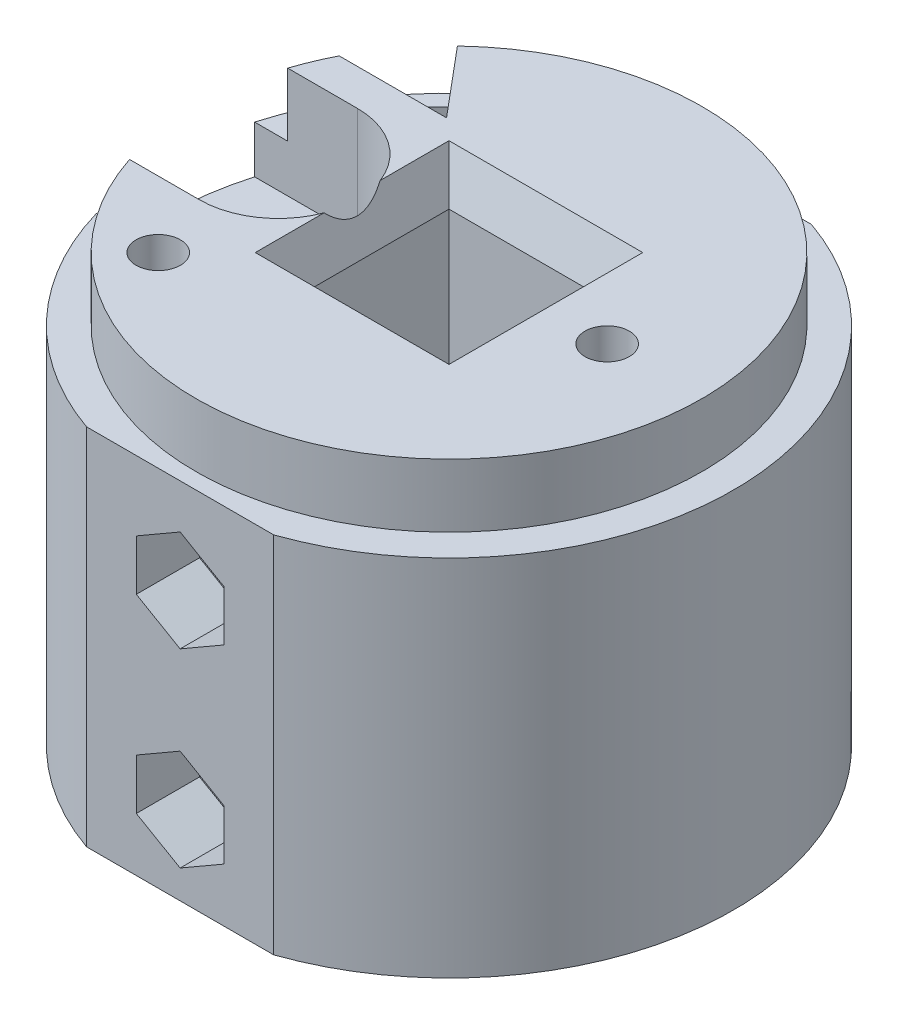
SolidWorks part; units mm, degrees
ref_plane "Спереди" through (0, 0, 0) normal (0, 0, 1) x (1, 0, 0)
ref_plane "Сверху" through (0, 0, 0) normal (0, 1, 0) x (1, 0, 0)
ref_plane "Справа" through (0, 0, 0) normal (1, 0, 0) x (0, 0, -1)
sketch "Sketch1" plane through (0, 0, 0) normal (0, 1, 0) x (1, 0, 0)
  line L0 (-5.125, 0) -> (-18, 0) construction
  line L1 (5.125, -5.125) -> (-5.125, -5.125)
  line L2 (5.125, -5.125) -> (5.125, 5.125)
  line L3 (5.125, 5.125) -> (-5.125, 5.125)
  line L4 (-5.125, -5.125) -> (-5.125, 5.125)
  line L5 (5.125, -5.125) -> (-5.125, 5.125) construction
  line L6 (5.125, 5.125) -> (-5.125, -5.125) construction
  circle A0 centre (0, 0) radius 18
  circle A1 centre (-12, 0) radius 2
  dimension "D1" = 36
  dimension "D3" = 6
  dimension "D2" = 10.25
extrude "Boss-Extrude1" add sketch "Sketch1" along normal blind 27
sketch "Sketch2" plane through (0, 27, 0) normal (0, 1, 0) x (1, 0, 0)
  line L0 (-10.8, 5) -> (-17.2916, 5)
  line L1 (-10.8, -5) -> (-17.2916, -5)
  line L2 (-5.125, 0) -> (-18, 0) construction
  line L3 (-5.125, 5.125) -> (-5.125, -5.125) construction
  circle A1 centre (0, 0) radius 18 construction
  arc A2 (-17.2916, 5) -> (-17.2916, -5) centre (0, 0) ccw
  arc A3 (-10.8, 5) -> (-10.8, -5) centre (-10.8, 0) cw
  point P12 (-5.8, 0)
  dimension "D1" = 5
extrude "Cut-Extrude1" cut sketch "Sketch2" against normal blind 7
sketch "Sketch4" plane through (0, 0, 0) normal (0, -1, 0) x (-1, 0, 0)
  line L0 (0, 0) -> (18, 21.4516) construction
  line L1 (0, 0) -> (18, -21.4516) construction
  line L2 (18, 21.4516) -> (18, -21.4516) construction
  line L3 (0, 0) -> (13.6996, 11.6756) construction
  line L4 (0, 0) -> (13.6996, -11.6756) construction
  line L5 (0, 0) -> (18, 0) construction
  line L6 (5.125, 5.125) -> (5.125, -5.125) construction
  line L7 (11.5702, 13.7888) -> (5.1423, 6.1284) construction
  line L8 (5.1423, 6.1284) -> (5.1423, -4.3826) construction
  line L9 (5.1423, -4.3826) -> (13.6996, -11.6756) construction
  line L10 (5.1423, 0.8729) -> (18.1354, 0.8729) construction
  line L12 (15.8104, 5.5479) -> (6.4604, 5.5479)
  line L13 (15.8104, 5.5479) -> (15.8104, -3.8021)
  line L14 (15.8104, -3.8021) -> (6.4604, -3.8021)
  line L15 (6.4604, 5.5479) -> (6.4604, -3.8021)
  line L16 (15.8104, 5.5479) -> (6.4604, -3.8021) construction
  line L17 (15.8104, -3.8021) -> (6.4604, 5.5479) construction
  arc A0 (13.6996, -11.6756) -> (11.5702, 13.7888) centre (0.5154, 0.0431) ccw construction
  circle A2 centre (0, 0) radius 18 construction
  point P2 (11, 0)
  point P5 (11.5702, 13.7888)
  point P7 (4.1157, 3.5076)
  point P8 (11.5702, -13.7888)
  point P11 (5.125, -6.1077)
  point P16 (11.1354, 0.8729)
  dimension "D5" = 10
  dimension "D1" = 100
  dimension "D2" = 3
  dimension "D3" = 3
  dimension "D4" = 9.35
  dimension "D6" = 7
extrude "Cut-Extrude3" cut sketch "Sketch4" against normal blind 15.4
sketch "Sketch5" plane through (0, 27, 0) normal (0, 1, 0) x (1, 0, 0)
  line L0 (0, 18) -> (0, -18) construction
  line L1 (5.9161, 17) -> (-5.9161, 17)
  line L2 (5.9161, -17) -> (-5.9161, -17)
  circle A0 centre (0, 0) radius 18 construction
  arc A1 (5.9161, 17) -> (-5.9161, 17) centre (0, 0) ccw
  arc A2 (5.9161, -17) -> (-5.9161, -17) centre (0, 0) cw
  point P11 (0, 17)
  dimension "D1" = 1
extrude "Cut-Extrude4" cut sketch "Sketch5" against normal blind 40
sketch "Sketch6" plane through (0, 0, -17) normal (0, 0, -1) x (-1, 0, 0)
  line L0 (0, 27) -> (0, 0) construction
  line L1 (5.9161, 27) -> (-5.9161, 27) construction
  line L3 (5.9161, 0) -> (-5.9161, 0) construction
  circle A0 centre (0, 17) radius 1.5
  circle A1 centre (0, 5) radius 1.5
  dimension "D1" = 3
  dimension "D2" = 10
  dimension "D3" = 5
extrude "Cut-Extrude5" cut sketch "Sketch6" against normal through all
sketch "Sketch7" plane through (0, 0, -17) normal (0, 0, -1) x (-1, 0, 0)
  circle A0 centre (0, 17) radius 3
  circle A1 centre (0, 5) radius 3
  dimension "D1" = 6
extrude "Cut-Extrude6" cut sketch "Sketch7" against normal blind 3
sketch "Sketch8" plane through (0, 0, 17) normal (0, 0, 1) x (1, 0, 0)
  line L0 (5.9161, 0) -> (5.9161, 27) construction
  line L1 (0, 13.8) -> (2.7713, 15.4)
  line L2 (2.7713, 15.4) -> (2.7713, 18.6)
  line L3 (2.7713, 18.6) -> (0, 20.2)
  line L4 (0, 20.2) -> (-2.7713, 18.6)
  line L5 (-2.7713, 18.6) -> (-2.7713, 15.4)
  line L6 (-2.7713, 15.4) -> (0, 13.8)
  line L9 (0, 1.8) -> (2.7713, 3.4)
  line L10 (2.7713, 3.4) -> (2.7713, 6.6)
  line L11 (2.7713, 6.6) -> (0, 8.2)
  line L12 (0, 8.2) -> (-2.7713, 6.6)
  line L13 (-2.7713, 6.6) -> (-2.7713, 3.4)
  line L14 (-2.7713, 3.4) -> (0, 1.8)
  circle A0 centre (0, 17) radius 3.2 construction
  circle A1 centre (0, 5) radius 3.2 construction
  dimension "D1" = 6.4
extrude "Cut-Extrude7" cut sketch "Sketch8" against normal blind 4
chamfer "Chamfer1" distance 1 angle 70 4 edges at (-5.125, 27, 0) (0, 27, -5.125) (0, 27, 5.125) (5.125, 27, 0)
sketch "Sketch9" plane through (0, 0, 0) normal (0, -1, 0) x (1, 0, 0)
  line L0 (16.4542, -7.2979) -> (-16.4542, -7.2979) construction
  line L1 (-15.8104, -5.5479) -> (-6.4604, -5.5479) construction
  line L2 (-7.4542, -7.2979) -> (-15.4542, -7.2979)
  line L3 (-7.4542, -7.2979) -> (-11.6323, -12.2772)
  line L4 (5.125, -5.125) -> (-5.125, -5.125) construction
  circle A0 centre (0, 0) radius 18 construction
  arc A1 (-15.4542, -7.2979) -> (-11.6323, -12.2772) centre (0.5168, 1.0043) ccw
  point P10 (-11.4542, -7.2979)
  dimension "D8" = 18
  dimension "D1" = 1.75
  dimension "D2" = 5
  dimension "D3" = 6.5
  dimension "D4" = 50
  dimension "D5" = 8
  dimension "D6" = 2.1729
  dimension "D7" = 23.9084
extrude "Cut-Extrude8" cut sketch "Sketch9" against normal through all
sketch "Sketch12" plane through (0, 27, 0) normal (0, 1, 0) x (1, 0, 0)
  line L0 (18, 0) -> (-10.8, 0) construction
  line L1 (0, 0) -> (-12.7279, -12.7279) construction
  arc A0 (5.9161, -17) -> (5.9161, 17) centre (0, 0) ccw construction
  arc A1 (-17.2916, -5) -> (-5.9161, -17) centre (0, 0) ccw construction
  circle A2 centre (10, 0) radius 1.4
  circle A3 centre (-9.1924, -9.1924) radius 1.4
  dimension "D1" = 2.8
  dimension "D2" = 10
  dimension "D3" = 13
extrude "Cut-Extrude10" cut sketch "Sketch12" against normal blind 20
sketch "Sketch10" plane through (0, 27, 0) normal (0, 1, 0) x (1, 0, 0)
  circle A1 centre (0, 0) radius 18
  circle A2 centre (0, 0) radius 16
  arc A3 (-17.2916, -5) -> (-5.9161, -17) centre (0, 0) ccw construction
  dimension "D1" = 2
extrude "Cut-Extrude9" cut sketch "Sketch10" against normal blind 4
